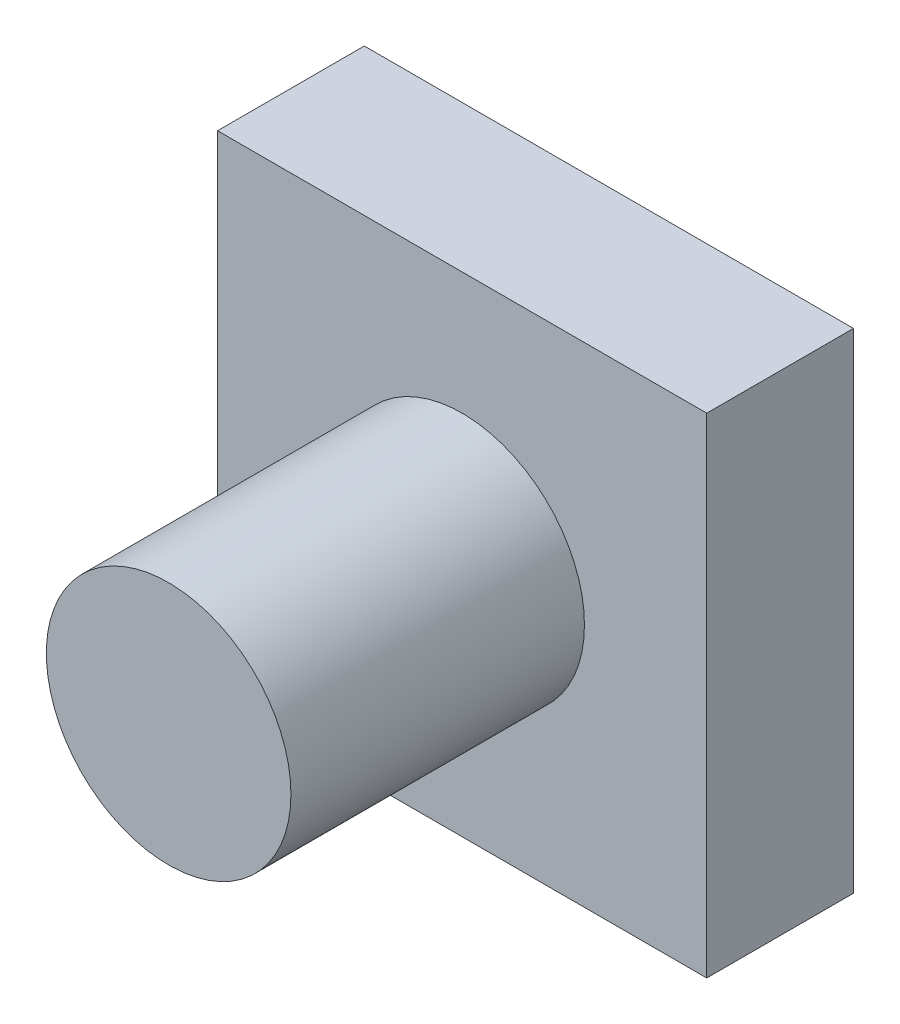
SolidWorks part; units mm, degrees
ref_plane "Plan de face" through (0, 0, 0) normal (0, 0, 1) x (1, 0, 0)
ref_plane "Plan de dessus" through (0, 0, 0) normal (0, 1, 0) x (1, 0, 0)
ref_plane "Plan de droite" through (0, 0, 0) normal (1, 0, 0) x (0, 0, -1)
sketch "Esquisse1" plane through (0, 0, 0) normal (0, 0, 1) x (1, 0, 0)
  line L1 (-250, 250) -> (250, 250)
  line L2 (-250, 250) -> (-250, -250)
  line L3 (-250, -250) -> (250, -250)
  line L4 (250, 250) -> (250, -250)
  dimension "D1" = 250
  dimension "D2" = 250
  dimension "D3" = 250
  dimension "D4" = 250
extrude "Boss.-Extru.1" add sketch "Esquisse1" along normal blind 150
sketch "Esquisse2" plane through (0, 0, 150) normal (0, 0, 1) x (1, 0, 0)
  circle A0 centre (0, 0) radius 125
  dimension "D1" = 250
extrude "Boss.-Extru.2" add sketch "Esquisse2" along normal blind 300
ref_point "origine_assemblage"
